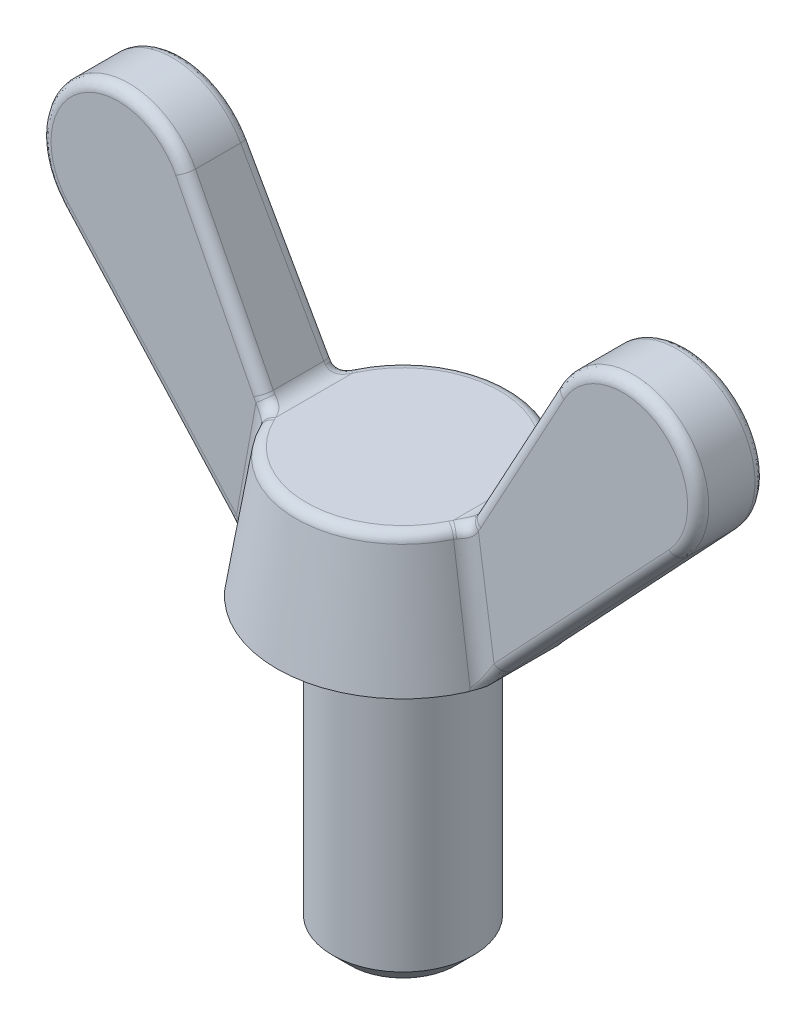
SolidWorks part; units mm, degrees
ref_plane "Front Plane" through (0, 0, 0) normal (0, 0, 1) x (1, 0, 0)
ref_plane "Top Plane" through (0, 0, 0) normal (0, 1, 0) x (1, 0, 0)
ref_plane "Right Plane" through (0, 0, 0) normal (1, 0, 0) x (0, 0, -1)
other "Configuration Table"
sketch "HeadSke" plane through (0, 0, 0) normal (0, 0, 1) x (1, 0, 0)
  line L0 (0, 0) -> (-21.5, 0)
  line L1 (-21.5, 0) -> (-18, 22)
  line L2 (-18, 22) -> (0, 22)
  line L3 (0, 22) -> (0, 0)
  line L4 (0, -38.5148) -> (0, 38.5148) construction
revolve "Head" add sketch "HeadSke" angle 360 about L4
sketch "BaseWingSke" plane through (0, 0, 0) normal (1, 0, 0) x (0, 0, -1)
  line L0 (0, 0) -> (0, 62.8635) construction
  line L1 (-5.5, 56) -> (-6.5, 0)
  line L2 (-5.5, 56) -> (5.5, 56)
  line L3 (5.5, 56) -> (6.5, 0)
  line L4 (6.5, 0) -> (-6.5, 0)
  point P8 (0, 56)
  dimension "TopWing_Width" = 11
  dimension "BottomWing_Width" = 13
  dimension "Height" = 56
extrude "BaseWing" add sketch "BaseWingSke" along normal mid plane 112
sketch "CutWingSke" plane through (0, 0, 0) normal (0, 0, 1) x (1, 0, 0)
  line L0 (0, 0) -> (0, 84.5075) construction
  line L1 (-20.4939, 0) -> (-52.4668, 34.043)
  line L2 (-16.9323, 22) -> (-31.4795, 49.126)
  line L3 (56, 56) -> (-56, 56) construction
  line L4 (-56, 56) -> (-56, 0) construction
  line L5 (-16.9323, 22) -> (16.9323, 22)
  line L6 (-20.4939, 0) -> (20.4939, 0)
  line L7 (20.4939, 0) -> (52.4668, 34.043)
  line L8 (16.9323, 22) -> (31.4795, 49.126)
  line L9 (-20.4939, 0) -> (-56, 0) construction
  line L10 (-66, 66) -> (66, 66)
  line L11 (-66, 66) -> (-66, -10)
  line L12 (-66, -10) -> (66, -10)
  line L13 (66, 66) -> (66, -10)
  line L14 (56, 56) -> (56, 0) construction
  arc A0 (-31.4795, 49.126) -> (-52.4668, 34.043) centre (-42.966, 42.966) ccw
  arc A1 (31.4795, 49.126) -> (52.4668, 34.043) centre (42.966, 42.966) cw
  dimension "D1" = 10
  dimension "Wing_ang" = 15
  dimension "D2" = 10
  dimension "D3" = 10
  dimension "D4" = 10
extrude "CutWing" cut sketch "CutWingSke" against normal mid plane 112
fillet "Fillet1" radius 3 6 edges at (-16.9323, 22, 0) (16.9323, 22, 0)
fillet "Fillet2" radius 1.8 30 edges at (-21.4266, 0.9931, 6.6579) (-37.3823, 17.9819, 6.1789) (-50.5726, 53.5502, 5.5437) (-24.9759, 36.9987, 5.8393) (-17.1926, 22.8149, 6.5578) (0, 22, -18) (0, 22, 18) (16.7923, 22.498, 6.9107) (24.9759, 36.9987, 5.8393) (21.2732, 0.8298, 6.7311) (37.3823, 17.9819, 6.1789) (21.4266, 0.9931, -6.6579) (37.3823, 17.9819, -6.1789) (50.5726, 53.5502, -5.5437) (-21.2732, 0.8298, -6.7311) (-37.3823, 17.9819, -6.1789) (-50.5726, 53.5502, -5.5437) (-24.9759, 36.9987, -5.8393) (-16.7923, 22.498, -6.9107) (17.1926, 22.8149, -6.5578) (50.5726, 53.5502, 5.5437) (24.9759, 36.9987, -5.8393)
sketch "BodySke" plane through (0, 0, 0) normal (0, 0, 1) x (1, 0, 0)
  line L0 (0, 0) -> (0, -98.4281) construction
  line L1 (-10.352, -22.6535) -> (-10.352, -78.0459) construction
  line L2 (0, 0) -> (-12, 0)
  line L3 (0, 0) -> (0, -50)
  line L4 (0, -50) -> (-12, -50)
  line L5 (-12, 0) -> (-12, -50)
  line L6 (9.5285, -48.5) -> (-28.2347, -48.5) construction
revolve "BaseBody" add sketch "BodySke" angle 360 about L0
sketch "ChamferedEndSke" plane through (0, 0, 0) normal (0, 0, 1) x (1, 0, 0)
  line L0 (-12, -47) -> (-12, -50)
  line L1 (-12, -50) -> (-9, -50)
  line L2 (-9, -50) -> (-12, -47)
  line L5 (0, 0) -> (0, -116.5105) construction
revolve "ChamferedEnd" cut sketch "ChamferedEndSke" angle 360 about L5
sketch "CutEndSke" plane through (0, -50, 0) normal (0, -1, 0) x (1, 0, 0)
  circle A0 centre (0, 0) radius 12 construction
  circle A1 centre (0, 0) radius 12
extrude "CutEnd" [suppressed] cut sketch "CutEndSke" against normal blind 3
dome "RoundedEnd" [suppressed] faces to dome 1 distance 3 parameters "D1"=3
sketch "ThdSchSke" plane through (0, 0, 0) normal (0, 0, 1) x (1, 0, 0)
  line L0 (0, 0) -> (0, -154.0819) construction
  line L1 (49.4883, -50) -> (-82.1477, -50) construction
  line L2 (13.9029, -46.4985) -> (12, -46.4985)
  line L3 (12, -46.4985) -> (10.352, -47.45)
  line L4 (10.352, -47.45) -> (12, -48.4015)
  line L5 (12, -48.4015) -> (13.9029, -48.4015)
  line L6 (13.9029, -48.4015) -> (13.9029, -46.4985)
revolve "ThreadSchematic" [suppressed] cut sketch "ThdSchSke" angle 360 about L0
pattern_linear "ThdSchPat" [suppressed] count 15 along (0, -1, 0)
equation "\"D1@CutWing\" = \"Width@BaseWing\""
equation "\"D1@Fillet1\" =\"Top_Width@HeadSke\"/12"
equation "\"D1@Fillet2\" = \"Top_Width@HeadSke\"/20"
equation "\"Thread_minor@ThreadCosmetic\" = \"Minor_dia@BodySke\""
equation "\"D1@CutEnd\" = \"Chamfer_width@ChamferedEndSke\""
equation "\"D1@RoundedEnd\" = \"Chamfer_width@ChamferedEndSke\""
equation "\"Length@ThdSchSke\" = \"Length@BodySke\""
equation "\"D1@ThdSchSke\" = \"Minor_dia@BodySke\""
equation "\"D2@ThdSchSke\" = \"Diameter@BodySke\""
equation "\"D3@ThdSchSke\" = \"Advance@BodySke\"*0.85"
equation "\"Advance@ThdSchPat\" = \"Advance@BodySke\""
equation "\"D1@ThdSchPat\" =  int( \"Length@BodySke\" / \"Advance@BodySke\" ) -1"
